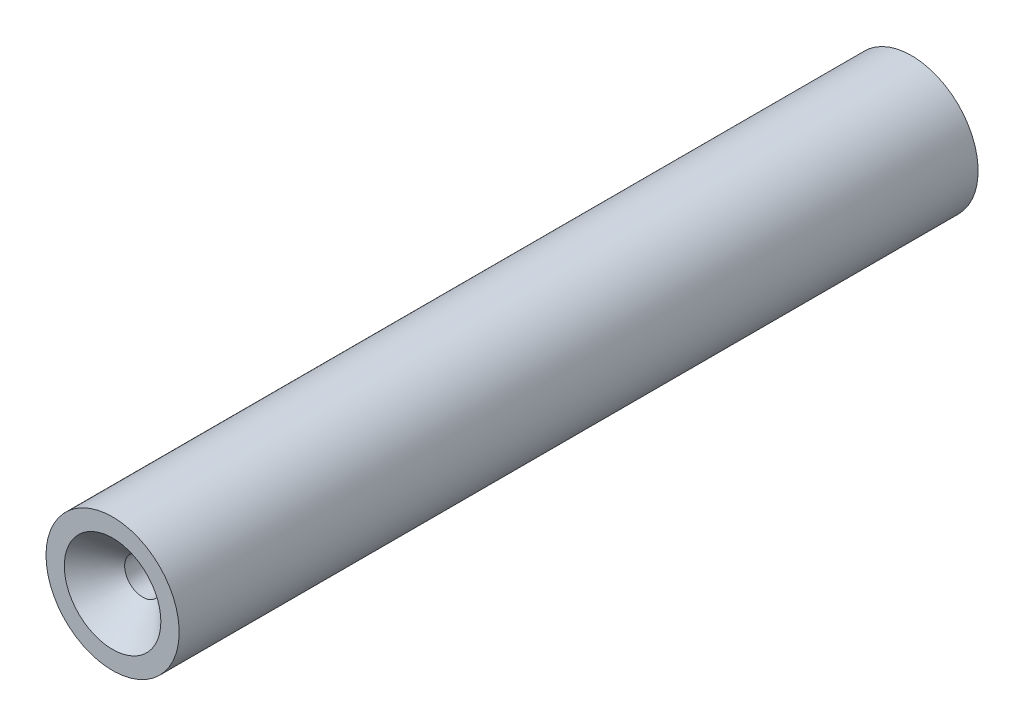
SolidWorks part; units mm, degrees
ref_plane "Front Plane" through (0, 0, 0) normal (0, 0, 1) x (1, 0, 0)
ref_plane "Top Plane" through (0, 0, 0) normal (0, 1, 0) x (1, 0, 0)
ref_plane "Right Plane" through (0, 0, 0) normal (1, 0, 0) x (0, 0, -1)
sketch "Sketch1" plane through (0, 0, 0) normal (0, 0, 1) x (1, 0, 0)
  circle A0 centre (-114.6632, 59.9895) radius 6.35
extrude "Boss-Extrude2" add sketch "Sketch1" along normal blind 76.2
hole_wizard "#8-32 Tapped Hole1" positions "Sketch2" profile "Sketch3" tap size "#8-32" standard "ANSI Inch"
sketch "Sketch2" plane through (0, 0, 76.2) normal (0, 0, 1) x (1, 0, 0)
  circle A0 centre (-114.6632, 59.9895) radius 6.35 construction
  point P0 (-114.6632, 59.9895)
  dimension "D1" = 0
sketch "Sketch3" plane through (-114.6632, 59.9895, 76.2) normal (1, 0, 0) x (0, -1, 0)
  line L0 (0, 0) -> (0, 13.7378)
  line L1 (0, 13.7378) -> (1.7272, 12.7)
  line L2 (1.7272, 12.7) -> (1.7272, 2.8765)
  line L3 (1.7272, 2.8765) -> (4.6037, 0)
  line L5 (4.6037, 0) -> (0, 0)
  line L6 (-1.7272, 2.8765) -> (-4.6037, 0) construction
  line L10 (0, 13.7378) -> (-1.7272, 12.7) construction
  line L11 (0, -6.35) -> (0, 107.95) construction
  dimension "Tap Drill Dia." = 3.4544
  dimension "Tap Drill Depth" = 12.7
  dimension "Near C'Sink Dia." = 9.2075
  dimension "Near C'Sink Angle" = 90
  dimension "Drill Angle" = 118
